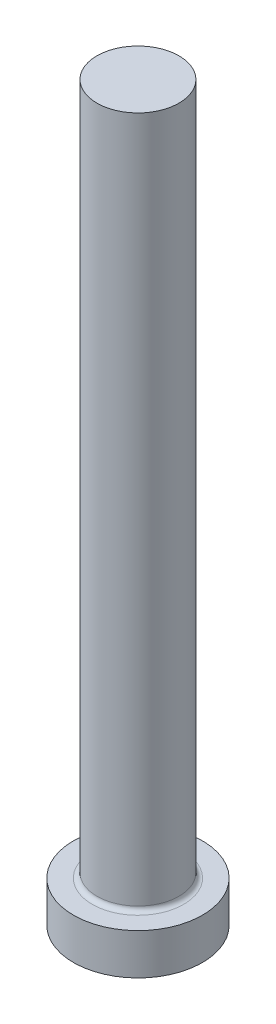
SolidWorks part; units mm, degrees
ref_plane "Plano frontal" through (0, 0, 0) normal (0, 0, 1) x (1, 0, 0)
ref_plane "Plano superior" through (0, 0, 0) normal (0, 1, 0) x (1, 0, 0)
ref_plane "Plano direito" through (0, 0, 0) normal (1, 0, 0) x (0, 0, -1)
sketch "Esboço1" plane through (0, 0, 0) normal (0, 0, 1) x (1, 0, 0)
  line L0 (0, 0) -> (11, 0)
  line L1 (11, 0) -> (11, 7)
  line L2 (11, 7) -> (7.8, 7)
  line L3 (7, 7.8) -> (7, 125)
  line L4 (7, 125) -> (0, 125)
  line L5 (0, 125) -> (0, 0) construction
  line L6 (0, 0) -> (0, 125)
  arc A0 (7.8, 7) -> (7, 7.8) centre (7.8, 7.8) cw
  dimension "D3" = 0.8
  dimension "D1" = 22
  dimension "D2" = 14
  dimension "D4" = 7
  dimension "D5" = 125
revolve "Revolução1" add sketch "Esboço1" angle 360 about L5
sketch "Esboço2"
  dimension "D1" = 0.825
  dimension "D2" = 1.925
  dimension "D3" = 1.2375
  dimension "D4" = 5.9125
wrap "Envolver1" sketch "Esboço2" wrap type deboss source sketch "Esboço2" thickness 0.1 parameters "D1"=0.1
